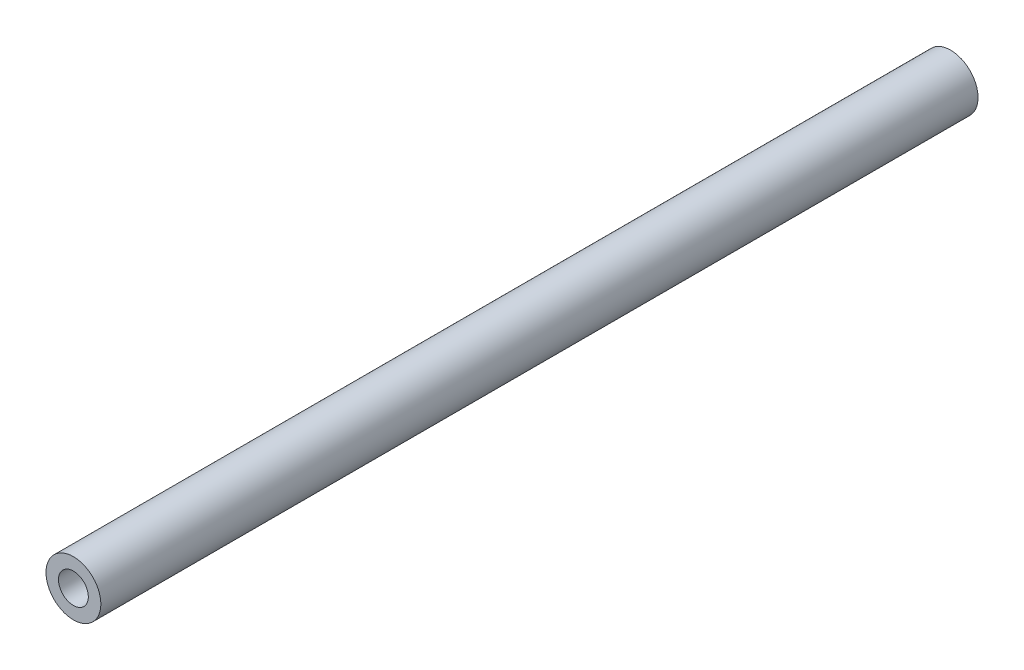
SolidWorks part; units mm, degrees
ref_plane "Front Plane" through (0, 0, 0) normal (0, 0, 1) x (1, 0, 0)
ref_plane "Top Plane" through (0, 0, 0) normal (0, 1, 0) x (1, 0, 0)
ref_plane "Right Plane" through (0, 0, 0) normal (1, 0, 0) x (0, 0, -1)
sketch "Sketch1" plane through (0, 0, 0) normal (0, 0, 1) x (1, 0, 0)
  circle A0 centre (0, 0) radius 3.175
  circle A1 centre (0, 0) radius 1.524
  dimension "D1" = 6.35
  dimension "D2" = 3.048
extrude "Extrude1" add sketch "Sketch1" along normal blind 101.6
hole_wizard "#8-32 Tapped Hole1" positions "Sketch3" profile "Sketch2" tap size "#8-32" standard "Ansi Inch"
sketch "Sketch3" plane through (0, 0, 0) normal (0, 0, -1) x (-1, 0, 0)
  point P0 (0, 0)
sketch "Sketch2" plane through (0, 0, 0) normal (1, 0, 0) x (0, 1, 0)
  line L0 (0, 0) -> (0, 13.4838)
  line L1 (0, 13.4838) -> (1.7272, 12.446)
  line L2 (1.7272, 12.446) -> (1.7272, 0)
  line L5 (1.7272, 0) -> (0, 0)
  line L10 (0, 13.4838) -> (-1.7272, 12.446) construction
  line L11 (0, -6.35) -> (0, 107.95) construction
  dimension "Tap Drill Dia." = 3.4544
  dimension "Tap Drill Depth" = 12.446
  dimension "Drill Angle" = 118
hole_wizard "#8-32 Tapped Hole2" positions "Sketch5" profile "Sketch4" tap size "#8-32" standard "Ansi Inch"
sketch "Sketch5" plane through (0, 0, 101.6) normal (0, 0, 1) x (1, 0, 0)
  point P0 (0, 0)
sketch "Sketch4" plane through (0, 0, 101.6) normal (1, 0, 0) x (0, -1, 0)
  line L0 (0, 0) -> (0, 13.4838)
  line L1 (0, 13.4838) -> (1.7272, 12.446)
  line L2 (1.7272, 12.446) -> (1.7272, 0)
  line L5 (1.7272, 0) -> (0, 0)
  line L10 (0, 13.4838) -> (-1.7272, 12.446) construction
  line L11 (0, -6.35) -> (0, 107.95) construction
  dimension "Tap Drill Dia." = 3.4544
  dimension "Tap Drill Depth" = 12.446
  dimension "Drill Angle" = 118
